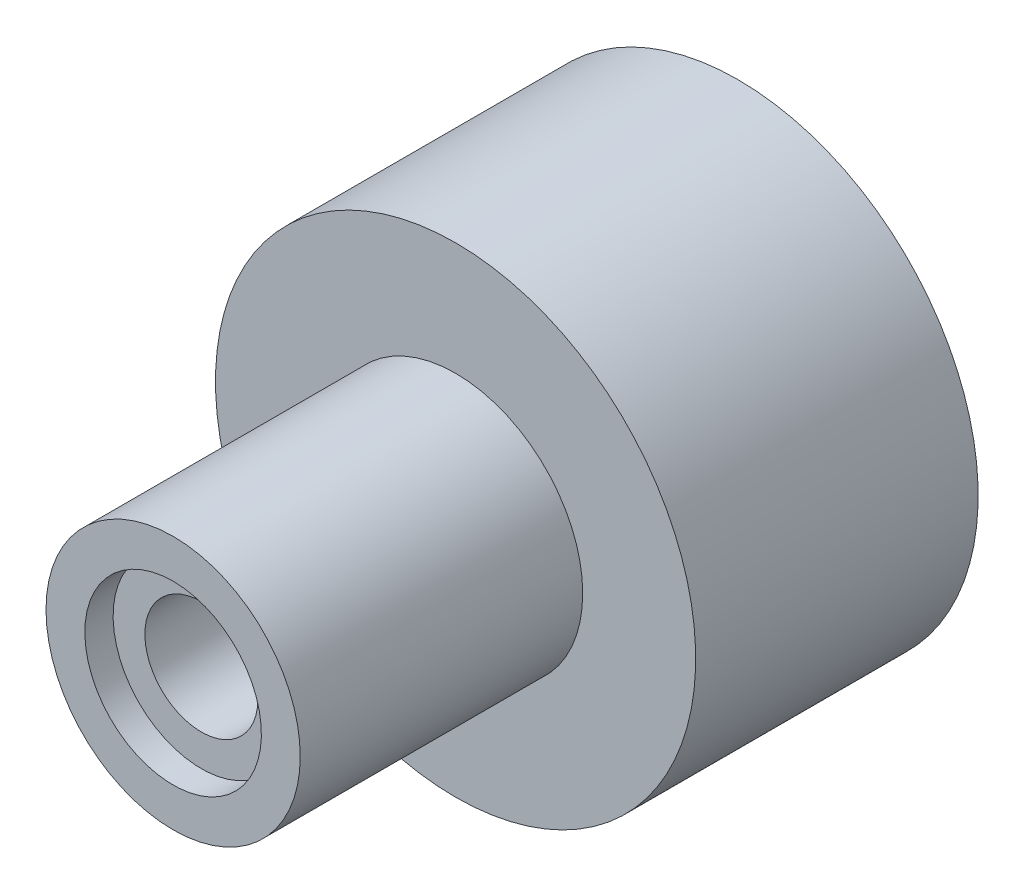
SolidWorks part; units mm, degrees
ref_plane "Front" through (0, 0, 0) normal (0, 0, 1) x (1, 0, 0)
ref_plane "Top" through (0, 0, 0) normal (0, 1, 0) x (1, 0, 0)
ref_plane "Right" through (0, 0, 0) normal (1, 0, 0) x (0, 0, -1)
imported_body "Imported1"
sketch "Sketch1" plane through (0, 0, 12) normal (0, 0, -1) x (-1, 0, 0)
  circle A0 centre (8.8388, -8.8388) radius 3 construction
  circle A1 centre (-8.8388, -8.8388) radius 3 construction
  circle A2 centre (-8.8388, 8.8388) radius 3 construction
  circle A3 centre (8.8388, 8.8388) radius 3 construction
  circle A4 centre (8.8388, -8.8388) radius 3
  circle A5 centre (-8.8388, -8.8388) radius 3
  circle A6 centre (-8.8388, 8.8388) radius 3
  circle A7 centre (8.8388, 8.8388) radius 3
extrude "Boss-Extrude1" add sketch "Sketch1" along normal blind 3
